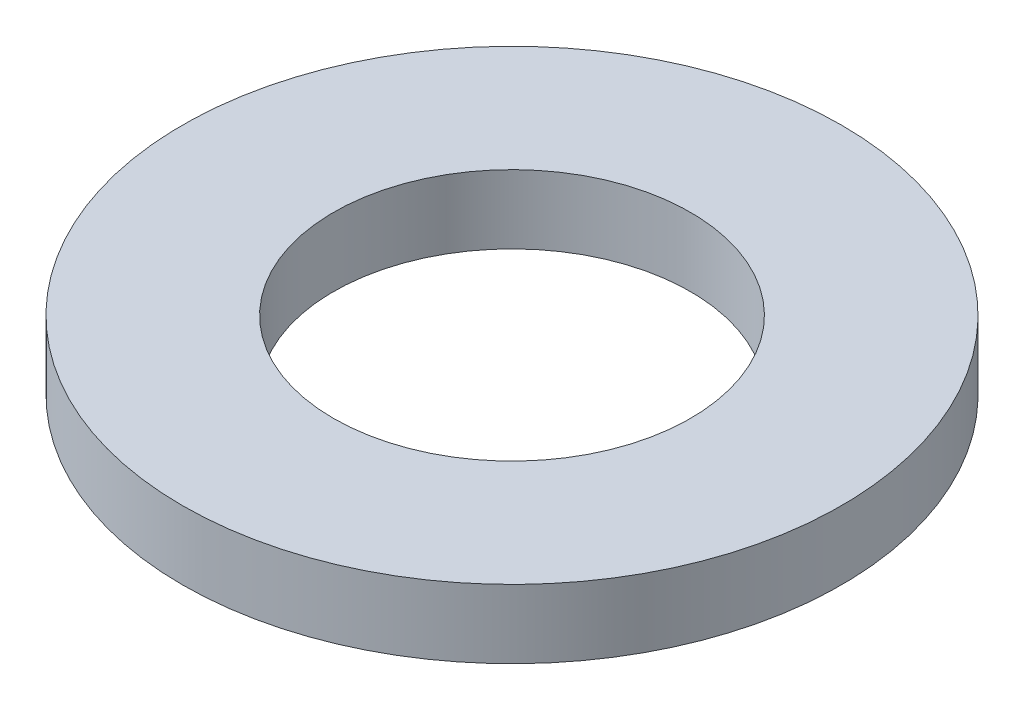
SolidWorks part; units mm, degrees
ref_plane "Front" through (0, 0, 0) normal (0, 0, 1) x (1, 0, 0)
ref_plane "Top" through (0, 0, 0) normal (0, 1, 0) x (1, 0, 0)
ref_plane "Right" through (0, 0, 0) normal (1, 0, 0) x (0, 0, -1)
sketch "Sketch1" plane through (0, 0, 0) normal (0, 1, 0) x (1, 0, 0)
  circle A0 centre (0, 0) radius 6.5
  circle A1 centre (0, 0) radius 12
extrude "Extrude1" add sketch "Sketch1" along normal blind 2.5
